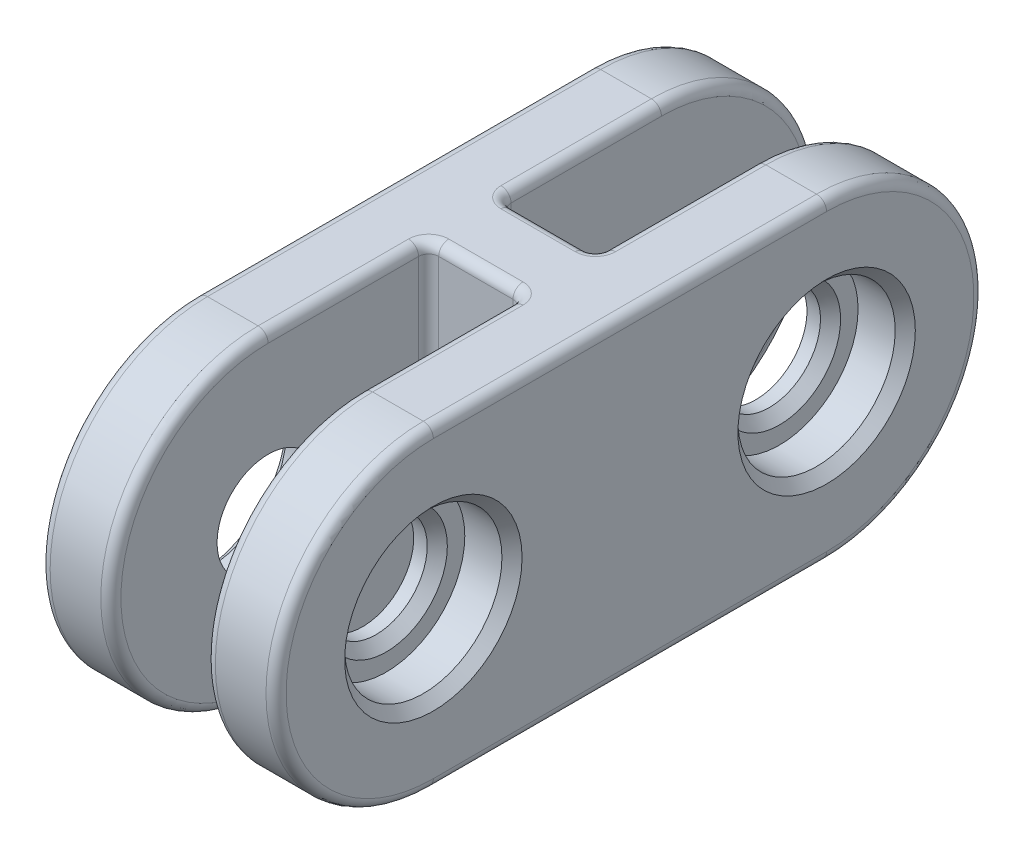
SolidWorks part; units mm, degrees
ref_plane "Front Plane" through (0, 0, 0) normal (0, 0, 1) x (1, 0, 0)
ref_plane "Top Plane" through (0, 0, 0) normal (0, 1, 0) x (1, 0, 0)
ref_plane "Right Plane" through (0, 0, 0) normal (1, 0, 0) x (0, 0, -1)
sketch "Sketch1" plane through (0, 0, 0) normal (1, 0, 0) x (0, 0, -1)
  line L0 (0, 12.7) -> (31.75, 12.7)
  line L1 (0, -12.7) -> (31.75, -12.7)
  circle A0 centre (0, 0) radius 4.1275
  circle A1 centre (31.75, 0) radius 4.1275
  arc A2 (31.75, -12.7) -> (31.75, 12.7) centre (31.75, 0) ccw
  arc A3 (0, 12.7) -> (0, -12.7) centre (0, 0) ccw
  dimension "D1" = 8.255
  dimension "D3" = 12.7
  dimension "D2" = 31.75
extrude "Extrude1" add sketch "Sketch1" along normal mid plane 19.05
sketch "Sketch2" plane through (9.525, 0, 0) normal (1, 0, 0) x (0, 0, -1)
  circle A0 centre (31.75, 0) radius 6.35
  circle A1 centre (31.75, 0) radius 4.1275 construction
  circle A2 centre (0, 0) radius 6.35
  circle A3 centre (0, 0) radius 4.1275 construction
  dimension "D1" = 12.7
extrude "Cut-Extrude1" cut sketch "Sketch2" against normal blind 3.81
mirror "Mirror1" about plane through (0, 0, 0) normal (1, 0, 0) of "Cut-Extrude1"
sketch "Sketch3" plane through (0, 12.7, 0) normal (0, 1, 0) x (-1, 0, 0)
  line L0 (-9.525, -15.875) -> (9.525, -15.875) construction
  line L1 (-9.525, -31.75) -> (-9.525, 0) construction
  line L2 (9.525, -31.75) -> (9.525, 0) construction
  line L3 (-9.525, -44.45) -> (9.525, -44.45) construction
  line L4 (3.81, -44.45) -> (-3.81, -44.45)
  line L5 (3.81, -44.45) -> (3.81, -18.796)
  line L6 (3.81, -18.796) -> (-3.81, -18.796)
  line L7 (-3.81, -44.45) -> (-3.81, -18.796)
  line L8 (3.81, 12.7) -> (3.81, -12.954)
  line L9 (3.81, 12.7) -> (-3.81, 12.7)
  line L10 (-3.81, 12.7) -> (-3.81, -12.954)
  line L11 (3.81, -12.954) -> (-3.81, -12.954)
  line L12 (0, -15.875) -> (0, -46.9783) construction
  dimension "D1" = 7.62
  dimension "D2" = 5.842
extrude "Cut-Extrude2" cut sketch "Sketch3" against normal through all
fillet "Fillet1" radius 0.8128 28 edges at (3.81, -12.7, -25.273) (3.81, 0, -44.45) (-3.81, -12.7, -25.273) (-3.81, 0, -44.45) (-3.81, -12.7, -6.477) (-3.81, 12.7, -6.477) (3.81, 12.7, -6.477) (3.81, -12.7, -6.477) (-9.525, 12.7, -15.875) (-9.525, 0, -44.45) (-9.525, -12.7, -15.875) (9.525, 12.7, -15.875) (9.525, 0, -44.45) (9.525, -12.7, -15.875) (3.81, 0, -18.796) (-3.81, 0, -18.796) (3.81, 0, -12.954) (-3.81, 0, -12.954) (0, -12.7, -18.796) (0, -12.7, -12.954) (0, 12.7, -12.954) (0, 12.7, -18.796) (3.81, 12.7, -25.273) (-3.81, 12.7, -25.273) (-3.81, 0, 12.7) (3.81, 0, 12.7) (-9.525, 0, 12.7) (9.525, 0, 12.7)
chamfer "Chamfer1" distance 0.8128 angle 45 8 edges at (-5.715, 0, -27.6225) (-9.525, 0, -38.1) (-5.715, 0, 4.1275) (-9.525, 0, -6.35) (5.715, 0, -4.1275) (9.525, 0, -6.35) (5.715, 0, -35.8775) (9.525, 0, -38.1)
